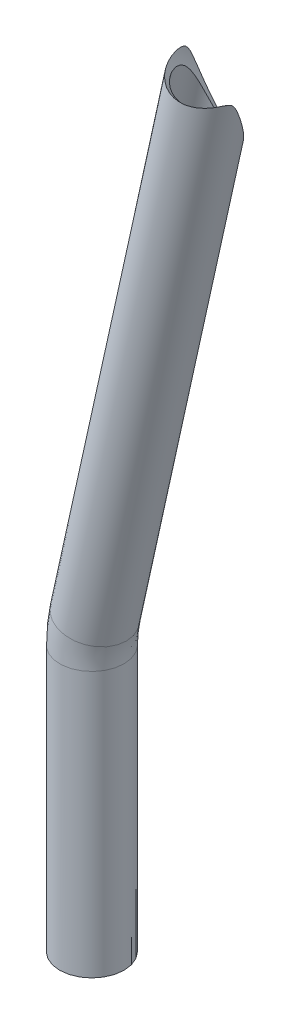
SolidWorks part; units mm, degrees
ref_plane "Plan de face" through (0, 0, 0) normal (0, 0, 1) x (1, 0, 0)
ref_plane "Plan de dessus" through (0, 0, 0) normal (0, 1, 0) x (1, 0, 0)
ref_plane "Plan de droite" through (0, 0, 0) normal (1, 0, 0) x (0, 0, -1)
sketch "Esquisse1" plane through (0, 0, 0) normal (0, 0, 1) x (1, 0, 0)
  line L0 (0, 0) -> (-54.5918, -247.5128)
  line L1 (-56, -260.4359) -> (-56, -383.8976)
  arc A0 (-56, -260.4359) -> (-54.5918, -247.5128) centre (4, -260.4359) cw
  point P6 (-56, -253.8976)
  dimension "D4" = 60
  dimension "D1" = 56
  dimension "D2" = 130
  dimension "D3" = 260
ref_plane "Plan1" through (-56, -383.8976, 0) normal (0, -1, 0) x (1, 0, 0)
sketch "Esquisse2" plane through (-56, -383.8976, 0) normal (0, -1, 0) x (1, 0, 0)
  circle A0 centre (0, 0) radius 13
  circle A1 centre (0, 0) radius 15
  dimension "D1" = 30
  dimension "D2" = 26
sweep "Balayage1" add profiles "Esquisse2" path "Esquisse1"
sketch "Esquisse3" plane through (0, 0, 0) normal (-0.0105, 0.6943, -0.7196) x (-0.9999, -0.0072, 0.0077)
  line L0 (0.2762, 25.006) -> (-0.4444, -40.231) construction
  line L1 (-2.4439, -221.2279) -> (4.5041, 407.7221) construction
  line L2 (12.5826, -218.9109) -> (19.5032, 407.5564) construction
  line L3 (15.2401, 21.6531) -> (0.2392, 21.6531)
  line L4 (15.2401, 21.6531) -> (15.2401, -36.3213)
  line L5 (15.2401, -36.3213) -> (-0.4012, -36.3213)
  line L6 (-0.4012, -36.3213) -> (0.2392, 21.6531)
  line L8 (-189.3256, 62.0951) -> (0.6628, 59.9963) construction
  dimension "D3" = 38.0948
revolve "Enlèvement de matière-Révolution2" cut sketch "Esquisse3" angle 360 about L0
